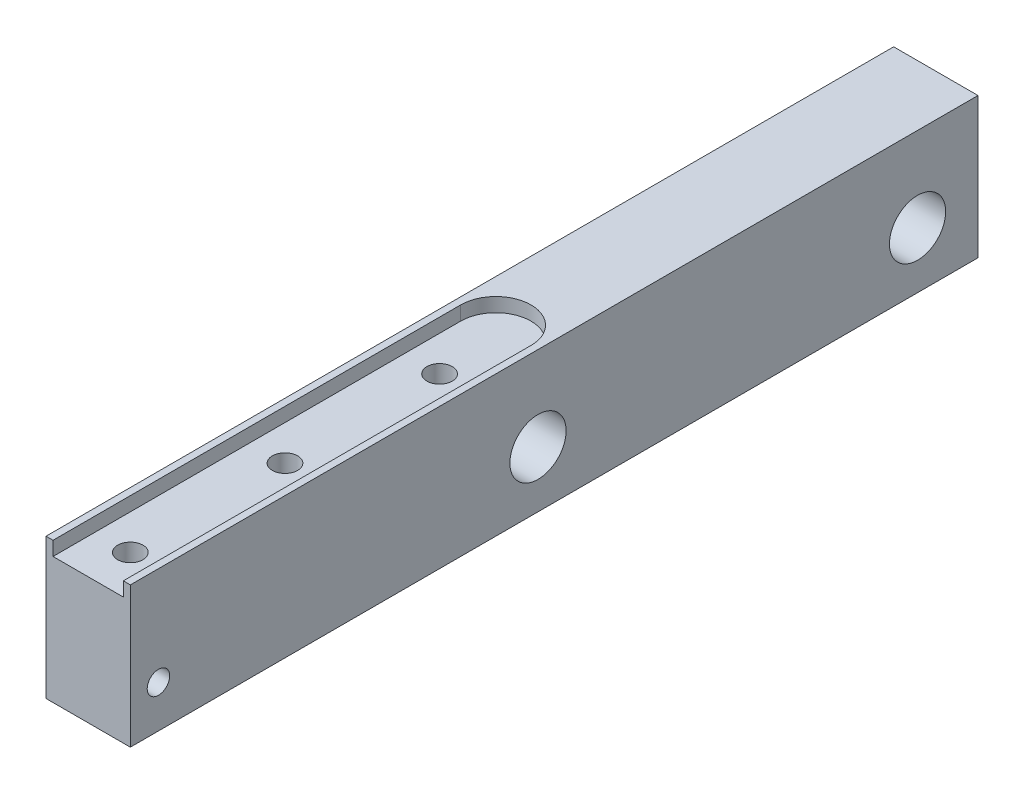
SolidWorks part; units mm, degrees
ref_plane "Face" through (0, 0, 0) normal (0, 0, 1) x (1, 0, 0)
ref_plane "Dessus" through (0, 0, 0) normal (0, 1, 0) x (1, 0, 0)
ref_plane "Droite" through (0, 0, 0) normal (1, 0, 0) x (0, 0, -1)
sketch "Esquisse1" plane through (0, 0, 0) normal (0, 0, 1) x (1, 0, 0)
  line L1 (-15, 25) -> (15, 25)
  line L2 (-15, 25) -> (-15, -25)
  line L3 (-15, -25) -> (15, -25)
  line L4 (15, 25) -> (15, -25)
  dimension "D1" = 30
  dimension "D2" = 50
  dimension "D3" = 25
  dimension "D4" = 15
extrude "Extrusion1" add sketch "Esquisse1" along normal blind 301.5
sketch "Esquisse2" plane through (15, 0, 0) normal (1, 0, 0) x (0, 0, -1)
  line L0 (-116.8081, -5) -> (-12.7196, -5) construction
  line L1 (-301.5, 25) -> (0, 25) construction
  line L2 (0, -25) -> (0, 25) construction
  circle A0 centre (-156.5, -5) radius 10
  circle A1 centre (-21.5, -5) radius 10
  dimension "D2" = 135
  dimension "D3" = 20
  dimension "D4" = 21.5
  dimension "D1" = 30
extrude "Enlèv. mat.-Extru.1" cut sketch "Esquisse2" against normal up to next
sketch "Esquisse3" plane through (0, 25, 0) normal (0, 1, 0) x (-1, 0, 0)
  line L0 (0, 0) -> (0, 301.5) construction
  line L1 (-15, 301.5) -> (15, 301.5) construction
  line L3 (12.5, 301.5) -> (-12.5, 301.5)
  line L4 (12.5, 301.5) -> (12.5, 156.5)
  line L6 (-12.5, 301.5) -> (-12.5, 156.5)
  arc A0 (-12.5, 156.5) -> (12.5, 156.5) centre (0, 156.5) ccw
  dimension "D1" = 25
  dimension "D2" = 145
extrude "Enlèv. mat.-Extru.2" cut sketch "Esquisse3" against normal blind 5
sketch "Esquisse4" plane through (15, 0, 0) normal (1, 0, 0) x (0, 0, -1)
  line L0 (-301.5, -25) -> (-301.5, 25) construction
  line L1 (-301.5, -25) -> (0, -25) construction
  circle A0 centre (-291.5, -10) radius 4
  dimension "D1" = 10
  dimension "D2" = 15
  dimension "D3" = 8
extrude "Enlèv. mat.-Extru.3" cut sketch "Esquisse4" against normal up to next
sketch "Esquisse5" plane through (0, 0, 0) normal (1, 0, 0) x (0, 0, -1)
  line L0 (-176.5, 36.5243) -> (-176.5, -14.6562) construction
  line L1 (-172, -5) -> (-176.5, -7.5981)
  line L2 (-176.5, 23.0313) -> (-172, 23.0313)
  line L3 (-301.5, 20) -> (-156.5, 20) construction
  line L4 (-176.5, 23.0313) -> (-176.5, -7.5981)
  line L5 (-172, 23.0313) -> (-172, -5)
  circle A0 centre (-156.5, -5) radius 10 construction
  dimension "D1" = 20
  dimension "D2" = 60
  dimension "D3" = 4.5
  dimension "D4" = 25
revolve "Enlèvement de matière-Révolution1" cut sketch "Esquisse5" angle 360 about L0
pattern_linear "Répétition linéaire1" count 3 spacing 55 along (0, 0, 1) of "Enlèvement de matière-Révolution1"
sketch "Esquisse8" plane through (0, 0, 0) normal (1, 0, 0) x (0, 0, -1)
  line L0 (-51.5, -41.9555) -> (-51.5, 25) construction
  line L1 (-301.5, 25) -> (0, 25) construction
  line L2 (-51.5, -26.9818) -> (-49, -26.9818)
  line L3 (-49, -26.9818) -> (-49, -10)
  line L4 (-49, -10) -> (-51.5, -8.5566)
  line L5 (-301.5, -25) -> (0, -25) construction
  line L6 (-51.5, -26.9818) -> (-51.5, -8.5566)
  circle A0 centre (-21.5, -5) radius 10 construction
  dimension "D1" = 30
  dimension "D2" = 60
  dimension "D3" = 2.5
  dimension "D4" = 15
revolve "Enlèvement de matière-Révolution3" cut sketch "Esquisse8" angle 360 about L0
pattern_linear "Répétition linéaire2" count 2 spacing 150 along (0, 0, 1) of "Enlèvement de matière-Révolution3"
